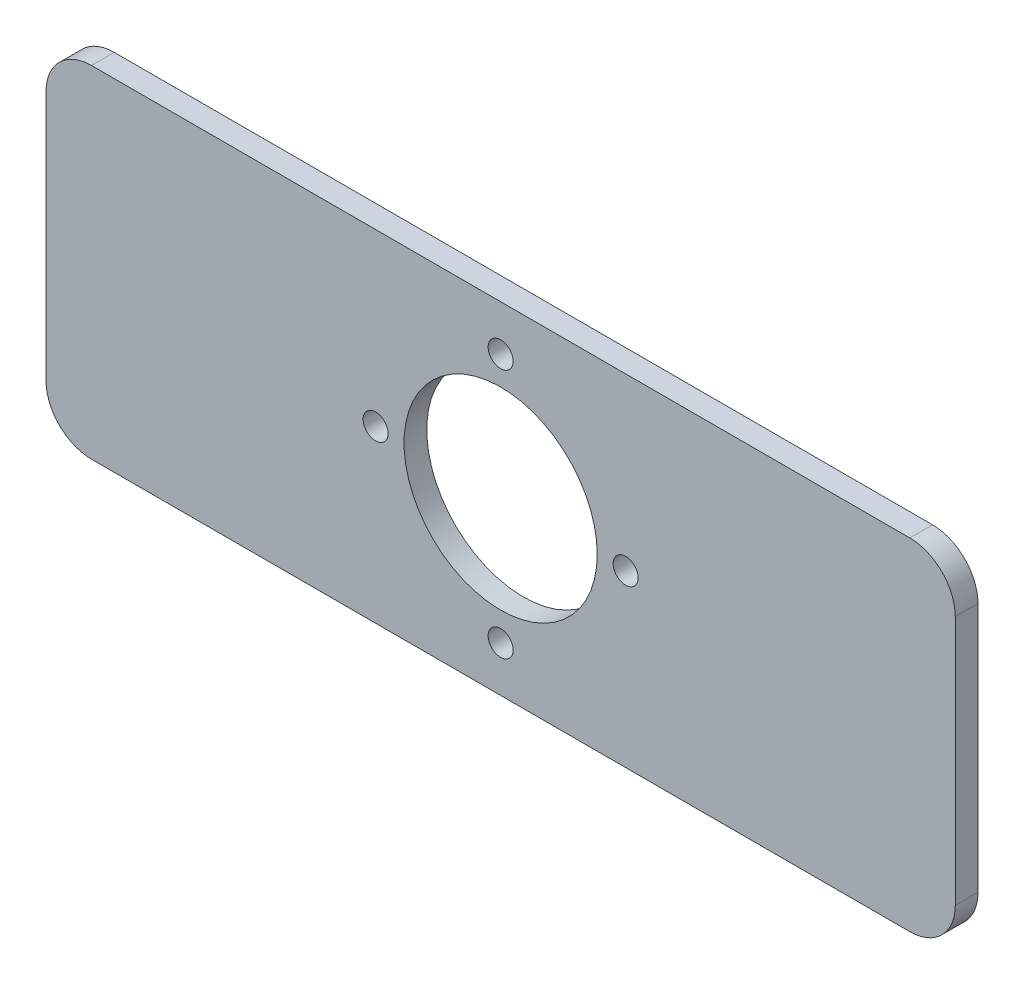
SolidWorks part; units mm, degrees
ref_plane "Face" through (0, 0, 0) normal (0, 0, 1) x (1, 0, 0)
ref_plane "Dessus" through (0, 0, 0) normal (0, 1, 0) x (1, 0, 0)
ref_plane "Droite" through (0, 0, 0) normal (1, 0, 0) x (0, 0, -1)
sketch "Esquisse1" plane through (0, 0, 0) normal (0, 0, 1) x (1, 0, 0)
  line L1 (20, 0) -> (380, 0)
  line L2 (0, -20) -> (0, -130)
  line L3 (20, -150) -> (380, -150)
  line L4 (400, -20) -> (400, -130)
  circle A0 centre (200, -75) radius 42.5
  circle A1 centre (200, -20) radius 5.5
  circle A2 centre (255, -75) radius 5.5
  circle A3 centre (200, -130) radius 5.5
  circle A4 centre (145, -75) radius 5.5
  arc A5 (400, -20) -> (380, 0) centre (380, -20) ccw
  arc A6 (380, -150) -> (400, -130) centre (380, -130) ccw
  arc A7 (0, -130) -> (20, -150) centre (20, -130) ccw
  arc A8 (20, 0) -> (0, -20) centre (20, -20) ccw
  point P17 (400, 0)
  point P22 (0, -150)
  point P25 (0, 0)
  dimension "D5" = 85
  dimension "D6" = 11
  dimension "D11" = 20
  dimension "D1" = 400
  dimension "D2" = 150
  dimension "D3" = 200
  dimension "D4" = 75
  dimension "D7" = 55
  dimension "D8" = 55
  dimension "D9" = 55
  dimension "D10" = 55
extrude "Base-Extrusion" add sketch "Esquisse1" along normal blind 10
